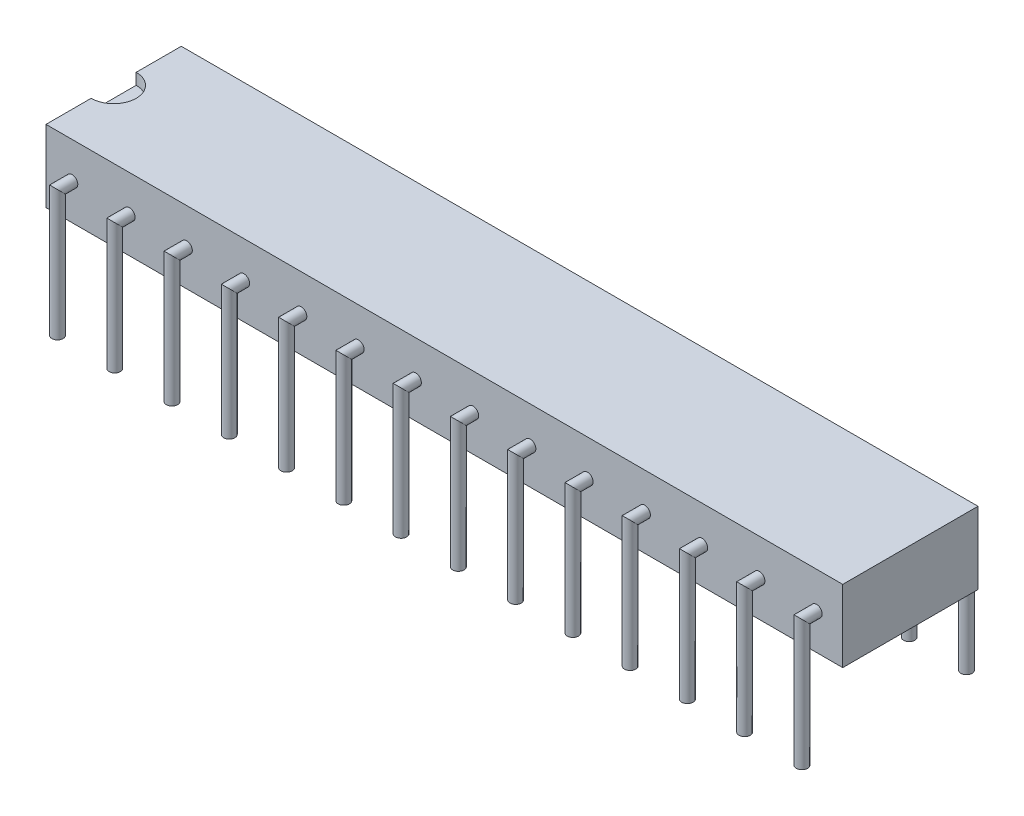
SolidWorks part; units mm, degrees
ref_plane "Plan de face" through (0, 0, 0) normal (0, 0, 1) x (1, 0, 0)
ref_plane "Plan de dessus" through (0, 0, 0) normal (0, 1, 0) x (1, 0, 0)
ref_plane "Plan de droite" through (0, 0, 0) normal (1, 0, 0) x (0, 0, -1)
sketch "Esquisse1" plane through (0, 0, 0) normal (1, 0, 0) x (0, 0, -1)
  line L0 (-34.0084, 0) -> (28.7946, 0) construction
  line L1 (0, -15.76) -> (0, 25.9507) construction
  line L2 (-13.1897, 3.2) -> (13.1184, 3.2) construction
  line L3 (3, 10.112) -> (3, -6.1718) construction
  line L4 (-3, 10.112) -> (-3, -4.99) construction
  line L6 (-3, 3.2) -> (3, 3.2)
  line L7 (-3, 3.2) -> (-3, 0)
  line L8 (-3, 0) -> (3, 0)
  line L9 (3, 3.2) -> (3, 0)
  dimension "D1" = 3
  dimension "D2" = 6
  dimension "D3" = 3.2
extrude "Extrusion1" add sketch "Esquisse1" along normal blind 35.34
sketch "Esquisse2" plane through (0, 3.2, 0) normal (0, 1, 0) x (-1, 0, 0)
  line L0 (0, -1) -> (0, 1)
  arc A0 (0, 1) -> (0, -1) centre (0, 0) ccw
extrude "Enlèv. mat.-Extru.1" cut sketch "Esquisse2" against normal blind 0.5
sketch "Esquisse3" plane through (0, 0, 3) normal (0, 0, 1) x (1, 0, 0)
  line L0 (-0.9705, 0) -> (10.7632, 0) construction
  line L1 (0, 4.319) -> (0, -1.0907) construction
  line L2 (-0.7349, 1.6) -> (2.3847, 1.6) construction
  line L3 (1.16, 2.698) -> (1.16, -1.0907) construction
  circle A0 centre (1.16, 1.6) radius 0.25
  dimension "D1" = 1.6
  dimension "D2" = 1.16
ref_plane "Plan1" through (1.16, 0, 0) normal (1, 0, 0) x (0, 0, -1)
sketch "Esquisse5" plane through (1.16, 0, 0) normal (1, 0, 0) x (0, 0, -1)
  line L0 (-4.2866, 0) -> (4.976, 0) construction
  line L1 (-3, -1.7147) -> (-3, 5.2592) construction
  line L2 (-4.2866, -4) -> (4.976, -4) construction
  line L3 (-3.65, -4.4343) -> (-3.65, 4.8284) construction
  line L4 (-3.7349, 1.6) -> (-3, 1.6) construction
  line L5 (-3, 1.6) -> (-3.65, 1.6)
  line L6 (-3.65, 1.6) -> (-3.65, -4)
  dimension "D1" = 4
  dimension "D2" = 0.65
sweep "Balayage1" add profiles "Esquisse3" path "Esquisse5"
ref_plane "Plan2" through (0, 0, 0) normal (0, 0, 1) x (1, 0, 0)
mirror "Symétrie1" about plane through (0, 0, 0) normal (0, 0, 1) of "Balayage1"
pattern_linear "Répétition linéaire1" count 14 spacing 2.54 along (1, 0, 0) of "Balayage1", "Symétrie1"
